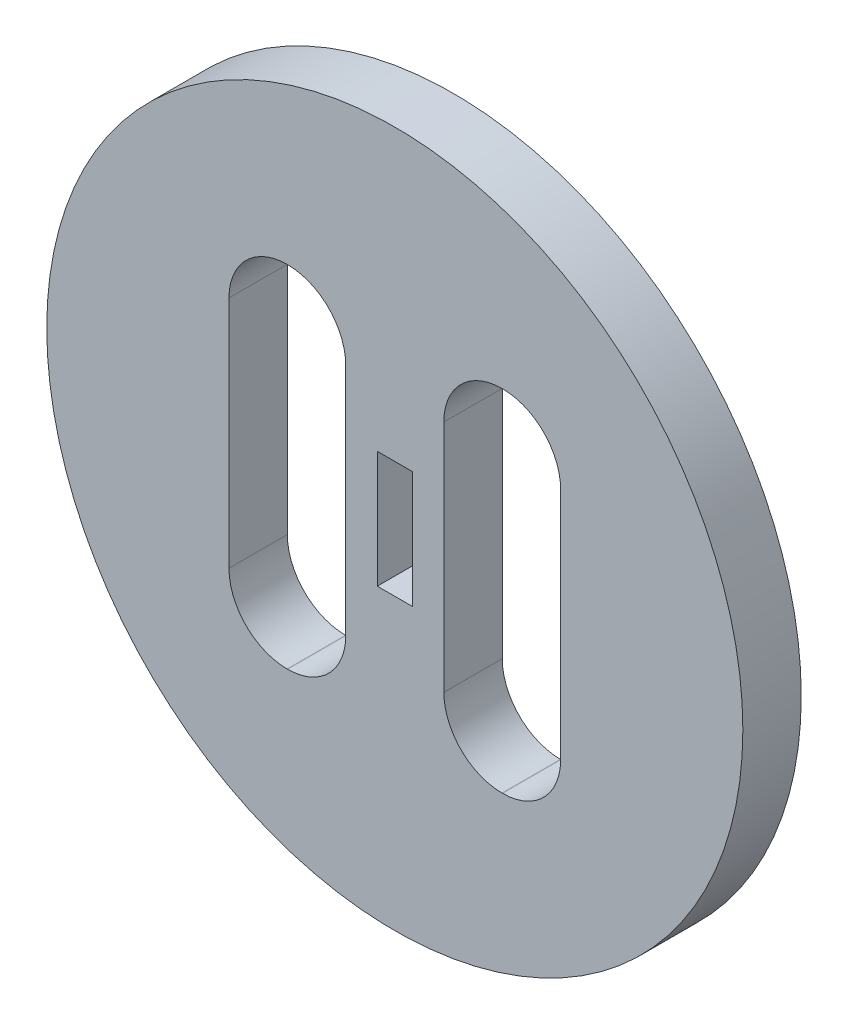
SolidWorks part; units mm, degrees
ref_plane "Front Plane" through (0, 0, 0) normal (0, 0, 1) x (1, 0, 0)
ref_plane "Top Plane" through (0, 0, 0) normal (0, 1, 0) x (1, 0, 0)
ref_plane "Right Plane" through (0, 0, 0) normal (1, 0, 0) x (0, 0, -1)
sketch "Sketch1" plane through (0, 0, 0) normal (0, 0, 1) x (1, 0, 0)
  circle A0 centre (0, 0) radius 37.846
  dimension "D1" = 75.692
extrude "Extrude1" add sketch "Sketch1" along normal blind 6.35
sketch "Sketch2" plane through (0, 0, 0) normal (0, 0, 1) x (1, 0, 0)
  line L0 (0, -29.206) -> (0, 29.28) construction
  line L1 (27.2748, 0) -> (-29.4666, 0) construction
  line L2 (-11.7094, 19.05) -> (-11.6586, 19.05)
  line L3 (-18.034, 12.7254) -> (-18.034, -12.7254)
  line L4 (-11.7094, -19.05) -> (-11.6586, -19.05)
  line L5 (-5.334, 12.7254) -> (-5.334, -12.7254)
  line L6 (11.6586, 19.05) -> (11.7094, 19.05)
  line L7 (5.334, 12.7254) -> (5.334, -12.7254)
  line L8 (11.6586, -19.05) -> (11.7094, -19.05)
  line L9 (18.034, 12.7254) -> (18.034, -12.7254)
  arc A0 (-18.034, 12.7254) -> (-11.7094, 19.05) centre (-11.7094, 12.7254) cw
  arc A1 (-5.334, 12.7254) -> (-11.6586, 19.05) centre (-11.6586, 12.7254) ccw
  arc A2 (-11.7094, -19.05) -> (-18.034, -12.7254) centre (-11.7094, -12.7254) cw
  arc A3 (-11.6586, -19.05) -> (-5.334, -12.7254) centre (-11.6586, -12.7254) ccw
  arc A4 (5.334, 12.7254) -> (11.6586, 19.05) centre (11.6586, 12.7254) cw
  arc A5 (18.034, 12.7254) -> (11.7094, 19.05) centre (11.7094, 12.7254) ccw
  arc A6 (11.7094, -19.05) -> (18.034, -12.7254) centre (11.7094, -12.7254) ccw
  arc A7 (5.334, -12.7254) -> (11.6586, -19.05) centre (11.6586, -12.7254) ccw
  point P15 (-18.034, 19.05)
  point P18 (-5.334, 19.05)
  point P21 (-18.034, -19.05)
  point P26 (5.334, 19.05)
  point P29 (18.034, 19.05)
  point P32 (18.034, -19.05)
  dimension "D5" = 5.334
  dimension "D9" = 6.3246
  dimension "D1" = 38.1
  dimension "D2" = 38.1
  dimension "D3" = 12.7
  dimension "D4" = 12.7
  dimension "D6" = 5.334
  dimension "D7" = 19.05
  dimension "D8" = 19.05
extrude "Cut-Extrude1" cut sketch "Sketch2" along normal through all
sketch "Sketch3" plane through (0, 0, 0) normal (0, 0, 1) x (1, 0, 0)
  line L0 (37.846, 0) -> (-37.846, 0) construction
  line L1 (-1.905, 6.35) -> (1.905, 6.35)
  line L2 (-1.905, 6.35) -> (-1.905, -6.35)
  line L3 (-1.905, -6.35) -> (1.905, -6.35)
  line L4 (1.905, 6.35) -> (1.905, -6.35)
  line L5 (0, -37.846) -> (0, 27.133) construction
  circle A0 centre (0, 0) radius 37.846 construction
  dimension "D1" = 3.81
  dimension "D2" = 12.7
  dimension "D3" = 6.35
  dimension "D4" = 1.905
extrude "Cut-Extrude2" cut sketch "Sketch3" along normal through all
